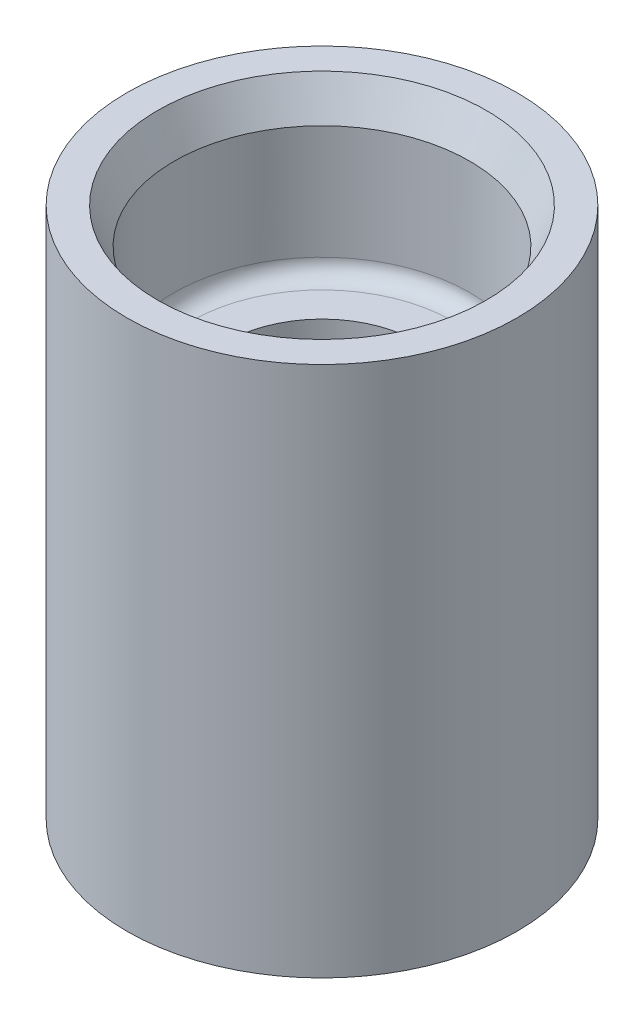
SolidWorks part; units mm, degrees
ref_plane "Front Plane" through (0, 0, 0) normal (0, 0, 1) x (1, 0, 0)
ref_plane "Top Plane" through (0, 0, 0) normal (0, 1, 0) x (1, 0, 0)
ref_plane "Right Plane" through (0, 0, 0) normal (1, 0, 0) x (0, 0, -1)
imported_body "female-waterconnector.stp<1>"
sketch "Sketch2" plane through (0, 32, 0) normal (0, 1, 0) x (1, 0, 0)
  line L0 (9.75, 11.75) -> (9.75, -11.75) construction
  circle A0 centre (9.75, 0) radius 11.75 construction
sketch "Sketch3" plane through (0, 22, 0) normal (0, 1, 0) x (1, 0, 0)
  line L0 (9.75, 11.75) -> (9.75, -11.75)
ref_plane "Plane1" through (9.75, 0, 0) normal (-1, 0, 0) x (0, 0, 1)
sketch "Sketch1" plane through (9.75, 0, 0) normal (1, 0, 0) x (0, 0, -1)
  line L0 (9.4, 32) -> (-9.4, 32) construction
  line L1 (8.9, 31.5) -> (-8.9, 31.5) construction
  line L2 (9.4, 32) -> (0, 32) construction
  line L3 (8.9, 31.5) -> (0, 31.5) construction
  line L4 (0, 32) -> (0, 31.5) construction
  line L5 (-8.9, 31.5) -> (-8.9, 32)
  line L6 (0, 32) -> (-8.9, 32) construction
  line L7 (-8.9, 32) -> (-9.4, 32)
  line L8 (0, 31.5) -> (-8.9, 31.5) construction
  arc A1 (-8.9, 31.5) -> (-9.4, 32) centre (-9.4, 31.5) ccw
revolve "Revolve1" add sketch "Sketch1" angle 360 about L4
chamfer "Chamfer1" distance 1 angle 65 1 edges at (9.75, 32, 8.9)
